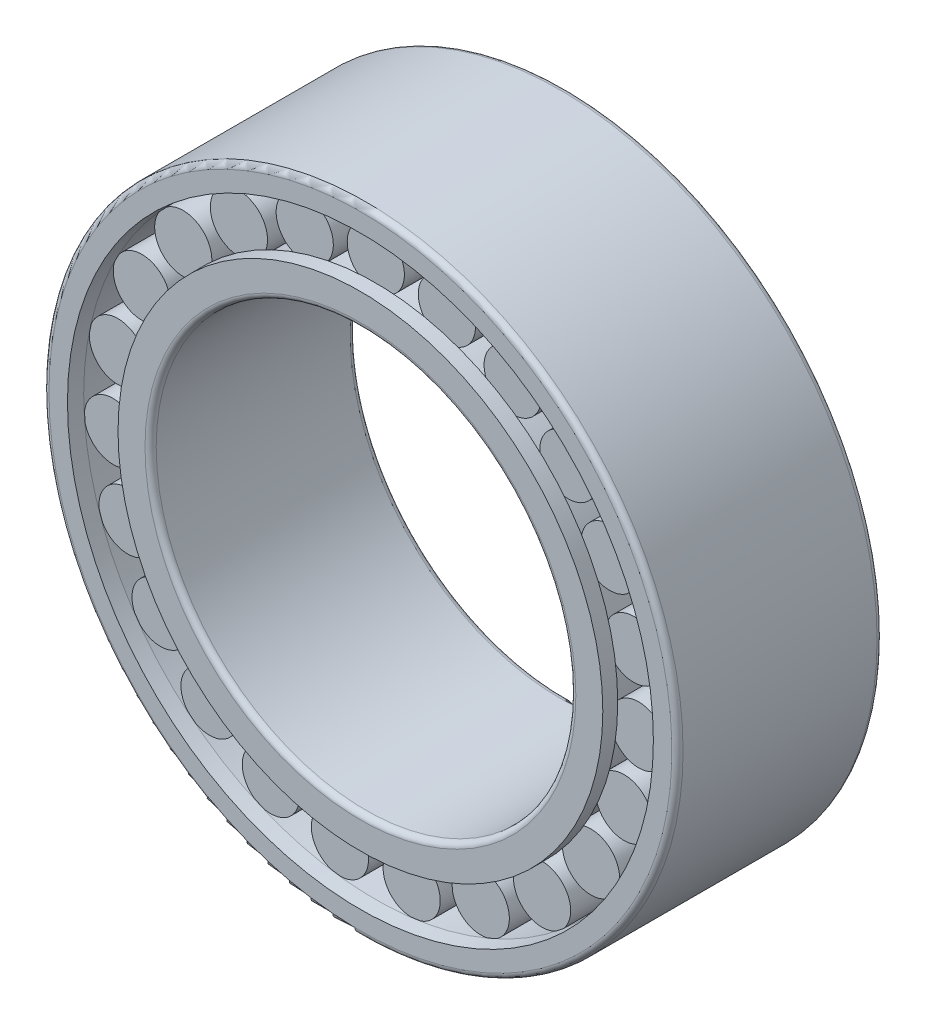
SolidWorks part; units mm, degrees
ref_plane "Front Plane" through (0, 0, 0) normal (0, 0, 1) x (1, 0, 0)
ref_plane "Top Plane" through (0, 0, 0) normal (0, 1, 0) x (1, 0, 0)
ref_plane "Right Plane" through (0, 0, 0) normal (1, 0, 0) x (0, 0, -1)
sketch "BaseSke" plane through (0, 0, 0) normal (1, 0, 0) x (0, 0, -1)
  line L0 (-47.2296, 0) -> (24.6132, 0) construction
  line L1 (-47.2296, 28.25) -> (24.6132, 28.25) construction
  line L2 (0, 129.5214) -> (0, -86.3012) construction
  line L3 (-9.35, 28.25) -> (-9.35, 31.3167) construction
  line L4 (-11, 34) -> (11, 34) construction
  line L5 (-11, 22.5) -> (11, 22.5) construction
  line L6 (-9.35, 25.1833) -> (-1.65, 25.1833)
  line L7 (-9.35, 25.1833) -> (-9.35, 28.25)
  line L8 (-9.35, 28.25) -> (-1.65, 28.25)
  line L9 (-1.65, 25.1833) -> (-1.65, 28.25)
  line L10 (-9.35, 31.3167) -> (-1.65, 31.3167) construction
  line L11 (-1.65, 31.3167) -> (-1.65, 28.25) construction
  dimension "D2" = 7.7
  dimension "D1" = 56.5
  dimension "Bearing_Thickness" = 22
  dimension "Bearing_Outside_Diameter" = 68
  dimension "Bearing_Inside_Diameter" = 45
  dimension "D3" = 3.0667
  dimension "D4" = 1.65
revolve "Roller" add sketch "BaseSke" angle 360 about L8
sketch "OuterRaceSke" plane through (0, 0, 0) normal (1, 0, 0) x (0, 0, -1)
  line L0 (0, 0) -> (0, 87.5396) construction
  line L1 (-11, 34) -> (11, 34)
  line L2 (-11, 34) -> (-11, 30.508)
  line L3 (-11, 30.508) -> (-9.4, 30.508)
  line L4 (11, 34) -> (11, 30.508)
  line L5 (-50.3916, 0) -> (55.2197, 0) construction
  line L6 (-9.35, 31.3167) -> (-1.65, 31.3167) construction
  line L7 (9.4, 30.508) -> (11, 30.508)
  line L9 (-9.4, 30.508) -> (-9.4, 31.2747)
  line L10 (-9.4, 31.2747) -> (9.4, 31.2747)
  line L11 (9.4, 30.508) -> (9.4, 31.2747)
  dimension "D1" = 18.8
  dimension "D2" = 0.7667
  dimension "D3" = 0.042
revolve "OuterRace" add sketch "OuterRaceSke" angle 360 about L5
mirror "Mirror1" about plane through (0, 0, 0) normal (0, 0, 1) of "Roller"
sketch "InnerRaceSke" plane through (0, 0, 0) normal (1, 0, 0) x (0, 0, -1)
  line L0 (-70.8626, 0) -> (113.5527, 0) construction
  line L1 (0, 58.441) -> (0, -70.8113) construction
  line L2 (-11, 22.5) -> (11, 22.5)
  line L3 (-11, 22.5) -> (-11, 25.992)
  line L4 (-9.4, 25.992) -> (-9.4, 25.2253)
  line L5 (-9.4, 25.992) -> (-11, 25.992)
  line L6 (0, 129.5214) -> (0, -86.3012) construction
  line L7 (-9.4, 25.2253) -> (9.4, 25.2253)
  line L9 (11, 22.5) -> (11, 25.992)
  line L10 (9.4, 25.992) -> (11, 25.992)
  line L11 (9.4, 25.2253) -> (9.4, 25.992)
  line L13 (-9.35, 25.1833) -> (-1.65, 25.1833) construction
  point P17 (0, 22.5)
  dimension "D2" = 0.042
  dimension "D1" = 18.8
  dimension "D3" = 0.7667
revolve "InnerRace" add sketch "InnerRaceSke" angle 360 about L0
sketch "Sketch1" plane through (0, 0, 0) normal (0, 1, 0) x (1, 0, 0)
  line L0 (0, 0) -> (-38.0176, 0) construction
  line L2 (-31.4146, -11) -> (-30.508, -11)
  line L3 (-31.4146, -11) -> (-31.2747, -9.4)
  line L4 (-31.2747, -9.4) -> (-30.508, -9.4)
  line L5 (-30.508, -11) -> (-30.508, -9.4)
  line L11 (-31.4146, 11) -> (-31.2747, 9.4)
  line L12 (-31.2747, 9.4) -> (-30.508, 9.4)
  line L13 (-30.508, 11) -> (-30.508, 9.4)
  line L14 (-31.4146, 11) -> (-30.508, 11)
  line L15 (0, -31.3296) -> (0, 36.1503) construction
  dimension "D1" = 5
revolve "Cut-Revolve1" cut sketch "Sketch1" angle 360 about L15
fillet "Fillet1" radius 0.6 4 edges at (22.5, 0, 11) (34, 0, -11) (34, 0, 11) (22.5, 0, -11)
pattern_circular "CirPatternBall" count 23 over 360 about axis through (0, 0, 0) along (0, 0, 1) of "Roller", "Mirror1"
sketch "SimplifiedSke" plane through (0, 0, 0) normal (1, 0, 0) x (0, 0, -1)
  line L0 (37.5911, 0) -> (-37.5911, 0) construction
  line L1 (-13.1351, 28.25) -> (13.151, 28.25) construction
  line L2 (-9.35, 31.3167) -> (-1.65, 31.3167)
  line L3 (-9.35, 31.3167) -> (-9.35, 25.1833)
  line L4 (-9.35, 25.1833) -> (-1.65, 25.1833)
  line L5 (-1.65, 31.3167) -> (-1.65, 25.1833)
  line L6 (-47.2296, 28.25) -> (24.6132, 28.25) construction
  line L7 (0, 0) -> (0, 50.4947) construction
  line L8 (1.65, 31.3167) -> (1.65, 25.1833)
  line L9 (9.35, 31.3167) -> (1.65, 31.3167)
  line L10 (9.35, 31.3167) -> (9.35, 25.1833)
  line L11 (9.35, 25.1833) -> (1.65, 25.1833)
revolve "Simplified" [suppressed] add sketch "SimplifiedSke" angle 360 about L0
equation "\"D2@BaseSke\" = \"Bearing_Thickness@BaseSke\"*0.35"
equation "\"D1@BaseSke\" =  ( \"Bearing_Inside_Diameter@BaseSke\" + \"Bearing_Outside_Diameter@BaseSke\" )  / 2"
equation "\"D3@BaseSke\" =  ( \"Bearing_Outside_Diameter@BaseSke\" - \"Bearing_Inside_Diameter@BaseSke\" )  / 7.5"
equation "\"D1@OuterRaceSke\" = \"Bearing_Thickness@BaseSke\"*0.85+0.1"
equation "\"D3@OuterRaceSke\" = 0.02+\"Bearing_Thickness@BaseSke\" * 0.001"
equation "\"D2@OuterRaceSke\" = \"D3@BaseSke\" * 0.25"
equation "\"D1@InnerRaceSke\" = \"Bearing_Thickness@BaseSke\"*0.85+0.1"
equation "\"D2@InnerRaceSke\" = \"D3@OuterRaceSke\""
equation "\"D3@InnerRaceSke\" = \"D2@OuterRaceSke\""
equation "\"D1@CirPatternBall\" =  int(  ( \"Bearing_Outside_Diameter@BaseSke\" + \"Bearing_Inside_Diameter@BaseSke\" )  / 2 *  pi  /  ( \"Bearing_Outside_Diameter@BaseSke\" - \"Bearing_Inside_Diameter@BaseSke\" ) * 3 ) "
equation "\"D4@BaseSke\" = \"Bearing_Thickness@BaseSke\" * 0.075"
